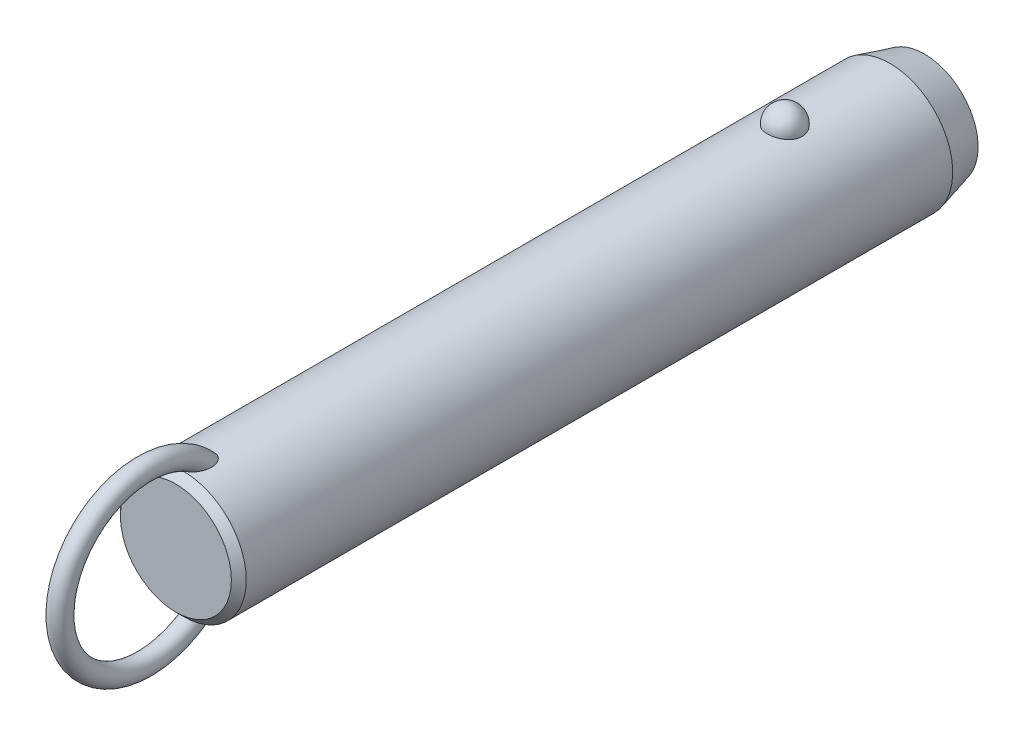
SolidWorks part; units mm, degrees
ref_plane "Front Plane" through (0, 0, 0) normal (0, 0, 1) x (1, 0, 0)
ref_plane "Top Plane" through (0, 0, 0) normal (0, 1, 0) x (1, 0, 0)
ref_plane "Right Plane" through (0, 0, 0) normal (1, 0, 0) x (0, 0, -1)
sketch "Sketch2" plane through (0, 0, 0) normal (0, 0, 1) x (1, 0, 0)
  circle A0 centre (0, 0) radius 12.7
  point P3 (0, 12.7)
  dimension "D1" = 25.4
extrude "Boss-Extrude1" add sketch "Sketch2" along normal blind 106.7
sketch "Sketch3" plane through (0, 0, 0) normal (0, 0, -1) x (-1, 0, 0)
  circle A0 centre (0, 0) radius 12.7
  dimension "D1" = 25.4
extrude "Boss-Extrude2" add sketch "Sketch3" along normal blind 31.7
chamfer "Chamfer1" distance 7 angle 15 1 edges at (-12.7, 0, -31.7)
sketch "Sketch12" plane through (0, 0, 0) normal (1, 0, 0) x (0, 0, -1)
  line L0 (-106.7, 12.7) -> (-106.7, -12.7) construction
  point P0 (-106.7, 0)
sketch "Sketch13" plane through (0, 0, 0) normal (1, 0, 0) x (0, 0, -1)
  circle A0 centre (-125.75, 0) radius 19.05
  point P2 (-106.7, 0)
  dimension "D1" = 38.1
sketch "Sketch14" plane through (0, 0, 0) normal (0, 1, 0) x (1, 0, 0)
  circle A0 centre (0, -108.7) radius 2
  point P2 (0, -106.7)
  dimension "D1" = 4
sweep "Sweep1" add profiles "Sketch14" path "Sketch13"
sketch "Sketch15" plane through (0, 0, 106.7) normal (0, 0, 1) x (1, 0, 0)
  circle A0 centre (0, 0) radius 12.7
  dimension "D1" = 25.4
extrude "Boss-Extrude3" add sketch "Sketch15" along normal blind 12.7
chamfer "Chamfer2" distance 1.5 angle 45 1 edges at (12.7, 0, 119.4)
sketch "Sketch18" plane through (0, 0, 0) normal (1, 0, 0) x (0, 0, -1)
  line L0 (24.7, 12.7) -> (-111.551, 12.7) construction
  line L1 (3.5, 16.2) -> (3.5, 9.2)
  line L2 (-111.551, -12.7) -> (24.7, -12.7) construction
  arc A0 (3.5, 16.2) -> (3.5, 9.2) centre (3.5, 12.7) ccw
  point P4 (0, 12.7)
  dimension "D1" = 28.9
revolve "Revolve1" add sketch "Sketch18" angle 360 about L1
